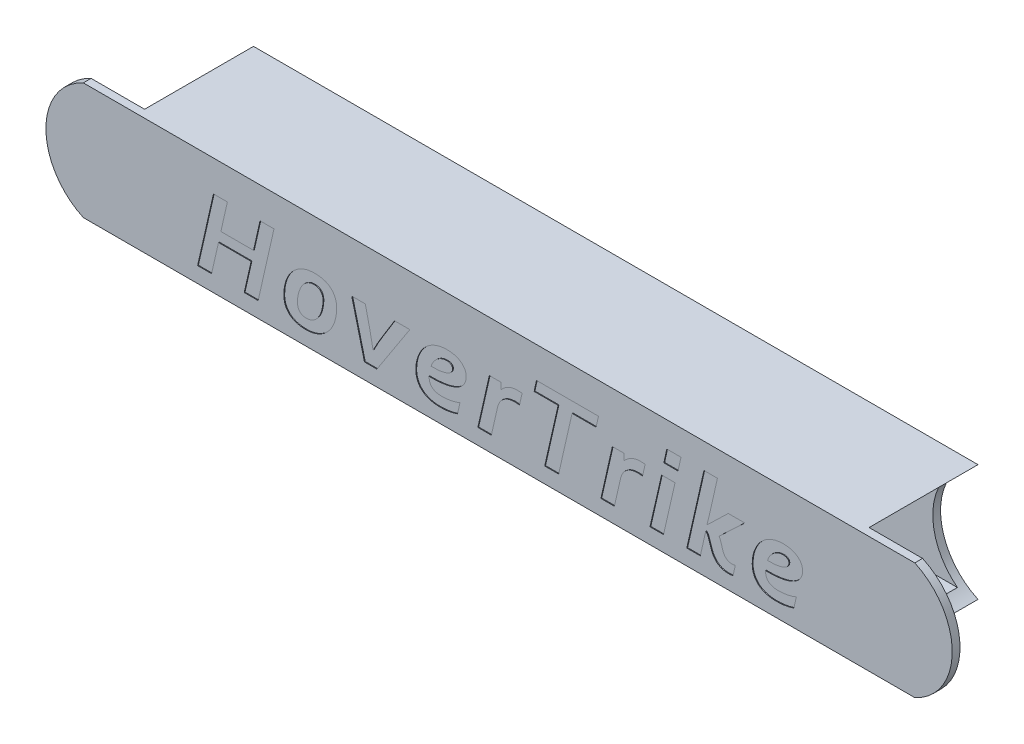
SolidWorks part; units mm, degrees
ref_plane "Plan de face" through (0, 0, 0) normal (0, 0, 1) x (1, 0, 0)
ref_plane "Plan de dessus" through (0, 0, 0) normal (0, 1, 0) x (1, 0, 0)
ref_plane "Plan de droite" through (0, 0, 0) normal (1, 0, 0) x (0, 0, -1)
sketch "Esquisse1" plane through (0, 0, 0) normal (1, 0, 0) x (0, 0, -1)
  line L0 (0, 0) -> (2, -2) construction
  line L1 (0, 0) -> (30, 0)
  line L2 (0, 0) -> (0, -30)
  line L3 (0, -30) -> (30, -30)
  line L4 (30, 0) -> (30, -30)
  line L5 (2, -2) -> (28, -2)
  line L6 (2, -2) -> (2, -28)
  line L7 (2, -28) -> (28, -28)
  line L8 (28, -2) -> (28, -28)
  line L9 (28, -28) -> (30, -30) construction
  dimension "D1" = 30
  dimension "D2" = 2
extrude "Boss.-Extru.1" add sketch "Esquisse1" along normal blind 116.5
sketch "Esquisse2" plane through (0, 0, -30) normal (0, 0, -1) x (-1, 0, 0)
  line L0 (-116.5, -30) -> (-116.5, 0) construction
  line L1 (-100, 0) -> (-100, -30) construction
  line L2 (-116.5, 0) -> (0, 0) construction
  line L3 (-116.5, -30) -> (0, -30) construction
  circle A0 centre (-100, -15) radius 16.5
  dimension "D1" = 33
sketch "Esquisse3" plane through (0, 0, -30) normal (0, 0, -1) x (-1, 0, 0)
  line L0 (-116.5, -30) -> (0, -30) construction
  line L1 (-106.8739, 0) -> (-116.5, 0)
  line L2 (-116.5, 0) -> (-116.5, -30) construction
  line L3 (-116.5, -30) -> (-106.8739, -30)
  line L4 (-116.5, 0) -> (-126.1261, 0)
  line L5 (-126.1261, 0) -> (-126.1261, -30)
  line L6 (-126.1261, -30) -> (-116.5, -30)
  arc A0 (-106.8739, 0) -> (-106.8739, -30) centre (-100, -15) ccw
  circle A1 centre (-100, -15) radius 16.5 construction
extrude "Enlèv. mat.-Extru.2" cut sketch "Esquisse3" against normal through all
extrude "Enlèv. mat.-Extru.3" cut sketch "Esquisse2" against normal up to surface (28 mm away)
mirror "Symétrie1" about plane through (0, 0, 0) normal (1, 0, 0) of "Enlèv. mat.-Extru.3", "Enlèv. mat.-Extru.2", "Boss.-Extru.1"
sketch "Esquisse4" plane through (0, 0, 0) normal (0, 0, 1) x (1, 0, 0)
  line L0 (-112.2984, -26) -> (112.2984, -26) construction
  line L1 (106.8739, -30) -> (-106.8739, -30) construction
  arc A0 (106.8739, -30) -> (106.8739, 0) centre (100, -15) ccw construction
  arc A1 (-106.8739, 0) -> (-106.8739, -30) centre (-100, -15) ccw construction
  text T0 "HoverTrike" font "Corbel" height 18
  dimension "D1" = 4
extrude "Enlèv. mat.-Extru.4" cut sketch "Esquisse4" against normal blind 0.2
